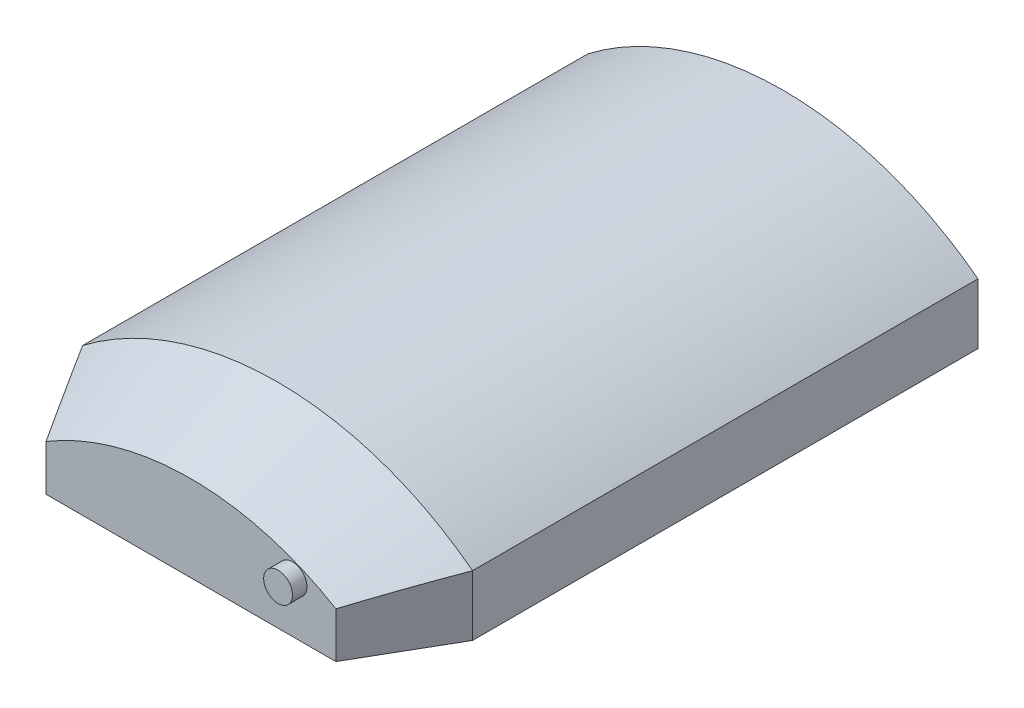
SolidWorks part; units mm, degrees
ref_plane "Front Plane" through (0, 0, 0) normal (0, 0, 1) x (1, 0, 0)
ref_plane "Top Plane" through (0, 0, 0) normal (0, 1, 0) x (1, 0, 0)
ref_plane "Right Plane" through (0, 0, 0) normal (1, 0, 0) x (0, 0, -1)
sketch "Sketch1" plane through (0, 0, 0) normal (0, 0, 1) x (1, 0, 0)
  line L0 (0, 0) -> (0, 85.725) construction
  line L1 (-85.725, 112.3093) -> (-85.725, 85.725)
  line L2 (-85.725, 85.725) -> (85.725, 85.725)
  line L3 (85.725, 85.725) -> (85.725, 112.3093)
  arc A0 (85.725, 112.3093) -> (-85.725, 112.3093) centre (0, 0) ccw
  dimension "D1" = 141.2875
  dimension "D2" = 85.725
  dimension "D3" = 85.725
  dimension "D4" = 85.725
extrude "Boss-Extrude1" add sketch "Sketch1" along normal blind 260.35
chamfer "Chamfer1" distance 38.1 angle 25 1 edges at (0, 141.2875, 260.35)
sketch "Sketch2" plane through (0, 85.725, 0) normal (0, -1, 0) x (1, 0, 0)
  line L0 (-63.728, 260.35) -> (-85.725, 222.25)
  line L1 (-85.725, 260.35) -> (85.725, 260.35) construction
  line L2 (-85.725, 260.35) -> (-85.725, 0) construction
  line L3 (-85.725, 222.25) -> (-85.725, 260.35)
  line L4 (-85.725, 260.35) -> (-63.728, 260.35)
  line L5 (-85.725, 222.25) -> (85.725, 222.25) construction
  line L6 (85.725, 260.35) -> (85.725, 0) construction
  line L7 (85.725, 222.25) -> (63.728, 260.35)
  line L8 (63.728, 260.35) -> (85.725, 260.35)
  line L9 (85.725, 260.35) -> (85.725, 222.25)
  dimension "D1" = 30
  dimension "D2" = 38.1
  dimension "D3" = 30
extrude "Cut-Extrude1" cut sketch "Sketch2" against normal through all
sketch "Sketch3" plane through (0, 0, 260.35) normal (0, 0, 1) x (1, 0, 0)
  line L0 (44.6735, 107.8524) -> (0, 107.8524) construction
  line L1 (0, 107.8524) -> (0, 0) construction
  line L2 (0, 0) -> (44.6735, 107.8524) construction
  circle A0 centre (44.6735, 107.8524) radius 6.35
  dimension "D3" = 12.7
  dimension "D1" = 44.6735
  dimension "D2" = 116.7384
extrude "Boss-Extrude2" add sketch "Sketch3" along normal blind 6.35
